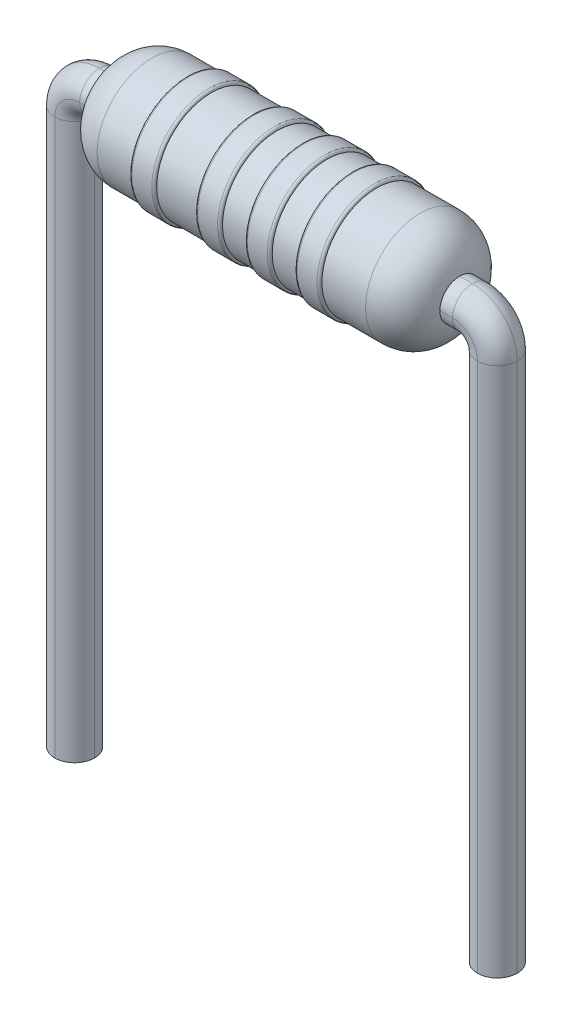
SolidWorks part; units mm, degrees
ref_plane "Face" through (0, 0, 0) normal (0, 0, 1) x (1, 0, 0)
ref_plane "Dessus" through (0, 0, 0) normal (0, 1, 0) x (1, 0, 0)
ref_plane "Droite" through (0, 0, 0) normal (1, 0, 0) x (0, 0, -1)
sketch "Esquisse1" plane through (0, 0, 0) normal (0, 0, 1) x (1, 0, 0)
  line L0 (-54.2687, 0) -> (62.1733, 0) construction
  line L1 (-48.4922, 1.1) -> (45.7559, 1.1) construction
  line L2 (-3.5, -1.6411) -> (-3.5, 4.3175) construction
  line L3 (0, -1.0268) -> (0, 4.1947) construction
  line L4 (3.5, 3.6009) -> (3.5, -1.9687) construction
  line L5 (-3.5, 0) -> (-3.5, 0.3)
  line L6 (-2.7, 1.1) -> (2.7, 1.1)
  line L7 (3.5, 0.3) -> (3.5, 0)
  line L8 (3.5, 0) -> (-3.5, 0)
  arc A0 (-2.7, 1.1) -> (-3.5, 0.3) centre (-2.7, 0.3) ccw
  arc A1 (3.5, 0.3) -> (2.7, 1.1) centre (2.7, 0.3) ccw
revolve "Base-Révolution" add sketch "Esquisse1" angle 360 about L0
sketch "Esquisse2" plane through (0, 0, 0) normal (0, 0, 1) x (1, 0, 0)
  line L0 (-3.3896, 1.15) -> (3.161, 1.15) construction
  line L1 (-2, 1.3889) -> (-2, -0.1179) construction
  line L2 (-1.5, 1.4925) -> (-1.5, -0.2136) construction
  line L3 (4.3262, 0) -> (-3.8651, 0) construction
  line L4 (1.323, 0) -> (1.823, 0)
  line L5 (0.323, 0) -> (0.823, 0)
  line L6 (-0.677, 1.15) -> (-0.677, 0)
  line L7 (0.323, 1.15) -> (0.323, 0)
  line L8 (1.323, 1.15) -> (1.323, 0)
  line L9 (-0.177, 1.15) -> (-0.177, 0)
  line L10 (0.823, 1.15) -> (0.823, 0)
  line L11 (1.823, 1.15) -> (1.823, 0)
  line L12 (-0.677, 0) -> (-0.177, 0)
  line L13 (-0.677, 1.15) -> (-0.177, 1.15)
  line L14 (0.323, 1.15) -> (0.823, 1.15)
  line L15 (1.323, 1.15) -> (1.823, 1.15)
  line L16 (-2, 1.15) -> (-1.5, 1.15)
  line L17 (-1.5, 1.15) -> (-1.5, 0)
  line L18 (-1.5, 0) -> (-2, 0)
  line L19 (-2, 0) -> (-2, 1.15)
revolve "Boss.-Révol.1" add sketch "Esquisse2" angle 360 about L3
fillet "Congé1" radius 0.05
sketch "Esquisse4" plane through (0, 0, 0) normal (0, 0, 1) x (1, 0, 0)
  line L0 (-5.2315, 0) -> (5.4216, 0) construction
  line L1 (-4.25, 1.8916) -> (-4.25, -12.2251) construction
  line L2 (4.25, 2.0093) -> (4.25, -12.4289) construction
  line L3 (4.65, -11.163) -> (3.85, -11.163)
  line L4 (-3.85, -11.6644) -> (-4.65, -11.6644)
  line L6 (-4.65, -0.5) -> (-4.65, -11.6644)
  line L7 (3.75, 0.4) -> (-3.75, 0.4)
  line L8 (4.65, -11.163) -> (4.65, -0.5)
  line L9 (-3.85, -0.5) -> (-3.85, -11.6644)
  line L10 (3.75, -0.4) -> (-3.75, -0.4)
  line L11 (3.85, -11.163) -> (3.85, -0.5)
  arc A2 (-4.65, -0.5) -> (-3.75, 0.4) centre (-3.75, -0.5) cw
  arc A3 (3.75, 0.4) -> (4.65, -0.5) centre (3.75, -0.5) cw
  arc A4 (-3.85, -0.5) -> (-3.75, -0.4) centre (-3.75, -0.5) cw
  arc A5 (3.75, -0.4) -> (3.85, -0.5) centre (3.75, -0.5) cw
extrude "Boss.-Extru.1" add sketch "Esquisse4" along normal mid plane 0.8
fillet "Congé7" radius 0.4
